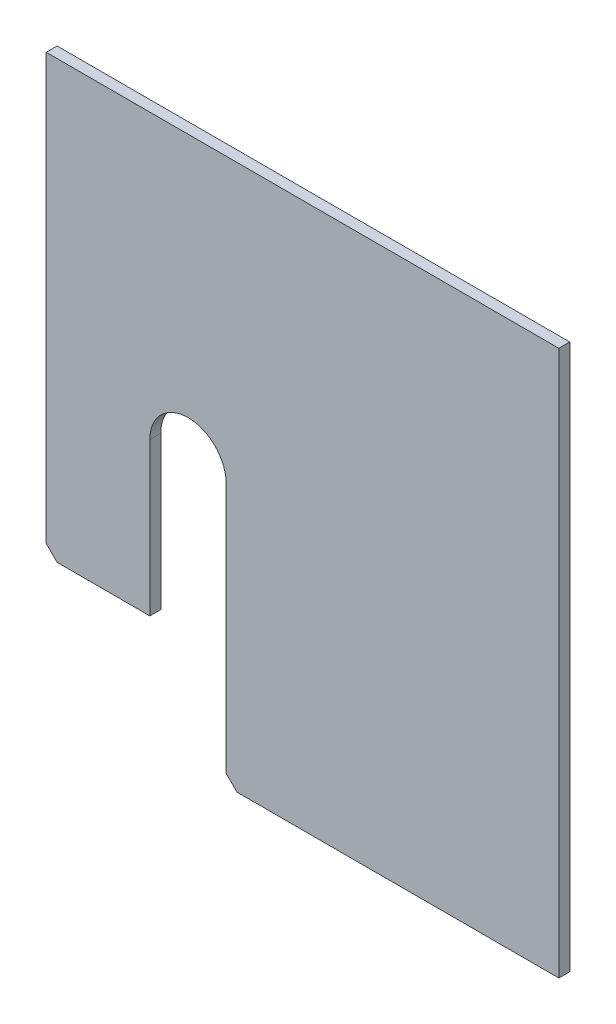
SolidWorks part; units mm, degrees
ref_plane "Plan de face" through (0, 0, 0) normal (0, 0, 1) x (1, 0, 0)
ref_plane "Plan de dessus" through (0, 0, 0) normal (0, 1, 0) x (1, 0, 0)
ref_plane "Plan de droite" through (0, 0, 0) normal (1, 0, 0) x (0, 0, -1)
sketch "Esquisse1" plane through (0, 0, 0) normal (0, 0, 1) x (1, 0, 0)
  line L0 (10, 100) -> (95, 100)
  line L1 (175, 0) -> (470, 0)
  line L2 (0, 110) -> (0, 500)
  line L3 (0, 500) -> (470, 500)
  line L4 (470, 0) -> (470, 500)
  line L5 (95, 100) -> (95, 240)
  line L6 (165, 240) -> (165, 10)
  line L7 (10, 100) -> (0, 110)
  line L8 (165, 10) -> (175, 0)
  arc A0 (165, 240) -> (95, 240) centre (130, 240) ccw
  point P5 (0, 100)
  point P9 (165, 0)
  dimension "D1" = 470
  dimension "D2" = 500
  dimension "D3" = 95
  dimension "D4" = 70
  dimension "D5" = 400
  dimension "D6" = 240
  dimension "D9" = 10
  dimension "D10" = 10
extrude "Boss.-Extru.1" add sketch "Esquisse1" along normal blind 10
